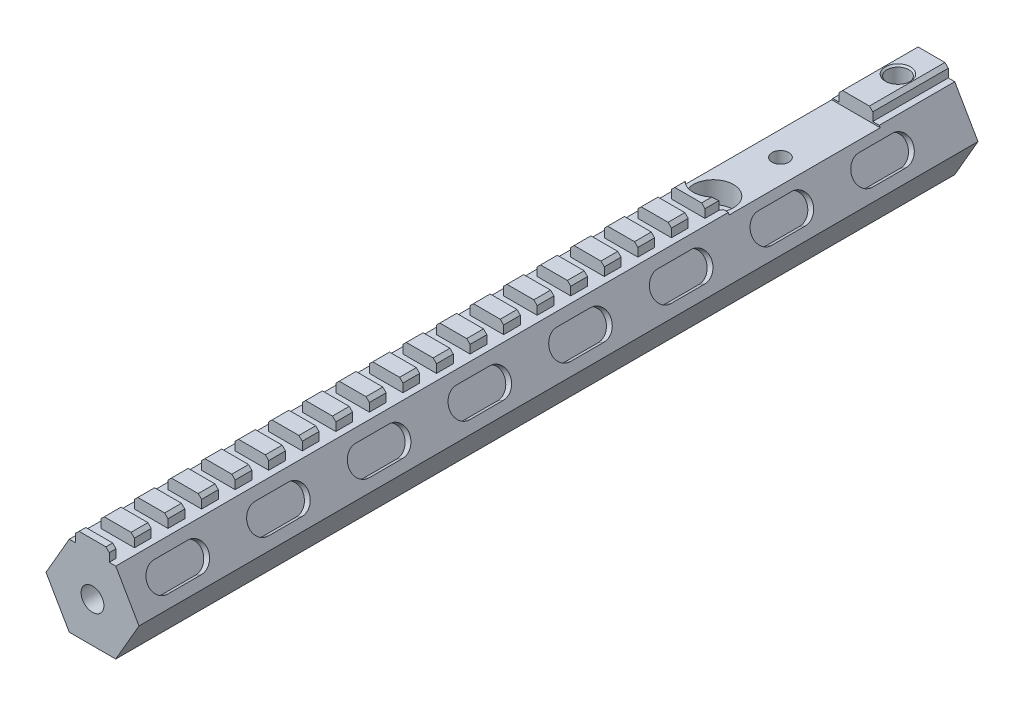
SolidWorks part; units mm, degrees
ref_plane "前视基准面" through (0, 0, 0) normal (0, 0, 1) x (1, 0, 0)
ref_plane "上视基准面" through (0, 0, 0) normal (0, 1, 0) x (1, 0, 0)
ref_plane "右视基准面" through (0, 0, 0) normal (1, 0, 0) x (0, 0, -1)
sketch "草图1" plane through (0, 0, 0) normal (0, 0, 1) x (1, 0, 0)
  line L1 (-13.8564, 0) -> (-6.9282, -12)
  line L2 (-6.9282, -12) -> (6.9282, -12)
  line L3 (6.9282, -12) -> (13.8564, 0)
  line L4 (13.8564, 0) -> (6.9282, 12)
  line L5 (6.9282, 12) -> (-6.9282, 12)
  line L6 (-6.9282, 12) -> (-13.8564, 0)
  circle A0 centre (0, 0) radius 12 construction
  point P1 (0, -12)
  dimension "D1" = 24
extrude "凸台-拉伸1" add sketch "草图1" along normal blind 250
sketch "草图2" plane through (0, 0, 0) normal (0, 0, 1) x (1, 0, 0)
  line L0 (6.9282, 12) -> (-6.9282, 12) construction
  line L1 (-5, 8.5) -> (5, 8.5)
  line L2 (-5, 8.5) -> (-5, 15.5)
  line L3 (-5, 15.5) -> (5, 15.5)
  line L4 (5, 8.5) -> (5, 15.5)
  line L5 (-5, 8.5) -> (5, 15.5) construction
  line L6 (-5, 15.5) -> (5, 8.5) construction
  point P0 (0, 12)
  dimension "D1" = 10
  dimension "D2" = 27.5
extrude "凸台-拉伸2" add sketch "草图2" along normal blind 22.5
chamfer "倒角3" distance 1 angle 45 2 edges at (-5, 15.5, 11.25) (5, 15.5, 11.25)
sketch "草图7" plane through (0, 0, 0) normal (0, 0, -1) x (-1, 0, 0)
  line L0 (-5, 12) -> (5, 12)
  line L13 (5, 12) -> (5, 14.5)
  line L14 (5, 14.5) -> (4, 15.5)
  line L15 (4, 15.5) -> (-4, 15.5)
  line L16 (-4, 15.5) -> (-5, 14.5)
  line L17 (-5, 14.5) -> (-5, 12)
  line L18 (-5, 12) -> (-6.9282, 12)
  line L19 (-6.9282, 12) -> (-13.8564, 0)
  line L20 (-13.8564, 0) -> (-6.9282, -12)
  line L21 (-6.9282, -12) -> (6.9282, -12)
  line L22 (6.9282, -12) -> (13.8564, 0)
  line L23 (13.8564, 0) -> (6.9282, 12)
  line L24 (6.9282, 12) -> (5, 12)
  line L25 (5, 12) -> (5, 14.5)
  line L26 (5, 14.5) -> (4, 15.5)
  line L27 (4, 15.5) -> (-4, 15.5)
  line L28 (-4, 15.5) -> (-5, 14.5)
  line L29 (-5, 14.5) -> (-5, 12)
  dimension "D1" = 0
extrude "凸台-拉伸3" add sketch "草图7" against normal blind 5 from offset 67.5
pattern_linear "阵列(线性)1" count 18 spacing 10 along (0, 0, 1) of "凸台-拉伸3"
sketch "草图8" plane through (0, 0, 242.5) normal (0, 0, 1) x (1, 0, 0)
  line L6 (5, 12) -> (5, 14.5)
  line L7 (5, 14.5) -> (4, 15.5)
  line L8 (4, 15.5) -> (-4, 15.5)
  line L9 (-4, 15.5) -> (-5, 14.5)
  line L10 (-5, 14.5) -> (-5, 12)
  line L11 (-5, 12) -> (5, 12)
  line L12 (5, 12) -> (5, 14.5)
  line L13 (5, 14.5) -> (4, 15.5)
  line L14 (4, 15.5) -> (-4, 15.5)
  line L15 (-4, 15.5) -> (-5, 14.5)
  line L16 (-5, 14.5) -> (-5, 12)
  line L17 (-5, 12) -> (5, 12)
  dimension "D1" = 0
extrude "凸台-拉伸4" add sketch "草图8" against normal blind 2 from surface at 7.5
sketch "草图10" plane through (-10.3923, 6, 0) normal (-0.866, 0.5, 0) x (0, 0, 1)
  line L0 (20, -0.0282) -> (30, -0.0282) construction
  line L1 (20, 3.9718) -> (30, 3.9718)
  line L2 (20, -4.0282) -> (30, -4.0282)
  line L3 (0, 6.9282) -> (0, -6.9282) construction
  line L6 (250, -6.9282) -> (0, -6.9282) construction
  arc A0 (20, 3.9718) -> (20, -4.0282) centre (20, -0.0282) ccw
  arc A1 (30, -4.0282) -> (30, 3.9718) centre (30, -0.0282) ccw
  point P3 (25, -0.0282)
  point P8 (16, -0.0282)
  point P11 (34, -0.0282)
  dimension "D3" = 4
  dimension "D1" = 16
  dimension "D2" = 18
  dimension "D4" = 2.9
extrude "切除-拉伸1" cut sketch "草图10" against normal blind 2
pattern_linear "阵列(线性)2" count 8 spacing 30 along (0, 0, 1) of "切除-拉伸1"
mirror "镜向1" about plane through (0, 0, 0) normal (1, 0, 0) of "阵列(线性)2", "切除-拉伸1"
sketch "草图11" plane through (0, 0, 0) normal (0, 0, -1) x (-1, 0, 0)
  line L0 (-3.6208, 6.7) -> (3.6208, 6.7)
  arc A0 (-8.1467, 3.825) -> (8.1467, 3.825) centre (0, 0) ccw
  arc A1 (8.1467, 3.825) -> (3.6208, 6.7) centre (3.6208, 1.7) ccw
  arc A2 (-8.1467, 3.825) -> (-3.6208, 6.7) centre (-3.6208, 1.7) cw
  dimension "D1" = 15.7
  dimension "D2" = 5
extrude "切除-拉伸2" cut sketch "草图11" against normal blind 21
sketch "草图12" plane through (0, 15.5, 0) normal (0, 1, 0) x (1, 0, 0)
  line L0 (4, 0) -> (-4, 0) construction
  circle A0 centre (0, -10) radius 3.25
  dimension "D1" = 6.5
  dimension "D2" = 10
extrude "切除-拉伸3" cut sketch "草图12" against normal up to next
chamfer "倒角5" distance 0.5 angle 45 1 edges at (0, 15.5, 13.25)
hole_wizard "M8 螺纹孔1" positions "草图13" profile "草图14" tap size "M8" standard "GB"
sketch "草图13" plane through (0, 0, 250) normal (0, 0, 1) x (1, 0, 0)
  point P0 (0, 0)
sketch "草图14" plane through (0, 0, 250) normal (1, 0, 0) x (0, -1, 0)
  line L0 (0, 0) -> (0, 27.0429)
  line L1 (0, 27.0429) -> (3.4, 25)
  line L2 (3.4, 25) -> (3.4, 0)
  line L5 (3.4, 0) -> (0, 0)
  line L10 (0, 27.0429) -> (-3.4, 25) construction
  line L11 (0, -6.35) -> (0, 107.95) construction
  dimension "螺纹孔钻头直径" = 6.8
  dimension "螺纹孔钻头深度" = 25
  dimension "导头角度" = 118
hole_wizard "M6 螺纹孔1" positions "草图15" profile "草图16" tap size "M6" standard "GB"
sketch "草图15" plane through (0, -12, 0) normal (0, -1, 0) x (-1, 0, 0)
  line L0 (6.9282, -250) -> (-6.9282, -250) construction
  point P0 (0, -170)
  dimension "D1" = 80
sketch "草图16" plane through (0, -12, 170) normal (1, 0, 0) x (0, 0, -1)
  line L0 (0, 0) -> (0, 16.5022)
  line L1 (0, 16.5022) -> (2.5, 15)
  line L2 (2.5, 15) -> (2.5, 0)
  line L5 (2.5, 0) -> (0, 0)
  line L10 (0, 16.5022) -> (-2.5, 15) construction
  line L11 (0, -6.35) -> (0, 107.95) construction
  dimension "螺纹孔钻头直径" = 5
  dimension "螺纹孔钻头深度" = 15
  dimension "导头角度" = 118
sketch "草图19" plane through (-10.3923, 6, 0) normal (-0.866, 0.5, 0) x (0, 0, 1)
sketch "草图20" plane through (0, 0, 0) normal (1, 0, 0) x (0, 0, -1)
  line L0 (-22.5, 11.5) -> (-67.5, 11.5)
  line L1 (-67.5, 11.5) -> (-67.5, 12)
  line L2 (-22.5, 11.5) -> (-22.5, 12)
  line L3 (-22.5, 14.5) -> (-22.5, 12) construction
  line L5 (-67.5, 12) -> (-67.5, 14.5) construction
  line L6 (-250, 12) -> (0, 12) construction
  point P2 (-22.5, 11.75)
  dimension "D1" = 0.5
extrude "切除-拉伸4" cut sketch "草图20" against normal through all and the other way through all
sketch "草图17" plane through (0, 0, 0) normal (1, 0, 0) x (0, 0, -1)
  line L0 (-65, 33.0007) -> (-65, -30.3352) construction
  line L1 (-65, 21.0456) -> (-59, 21.0456)
  line L2 (-59, 21.0456) -> (-59, 5.0456)
  line L3 (-59, 5.0456) -> (-61.3225, 5.0456)
  line L4 (-61.3225, 5.0456) -> (-61.3225, -16.4139)
  line L5 (-61.3225, -16.4139) -> (-65, -16.4139)
  line L6 (-65, -16.4139) -> (-65, 21.0456)
  dimension "D1" = 185
  dimension "D2" = 6
  dimension "D3" = 16
revolve "切除-旋转1" cut sketch "草图17" angle 360 about L0
hole_wizard "M6 螺纹孔2" positions "草图21" profile "草图22" tap size "M6" standard "GB"
sketch "草图21" plane through (0, 11.5, 0) normal (0, 1, 0) x (1, 0, 0)
  line L0 (7.2169, -22.5) -> (-7.2169, -22.5) construction
  point P0 (0, -45)
  point P5 (0, -22.5)
  dimension "D1" = 22.5
sketch "草图22" plane through (0, 11.5, 45) normal (1, 0, 0) x (0, 0, 1)
  line L0 (0, 0) -> (0, 16.5022)
  line L1 (0, 16.5022) -> (2.5, 15)
  line L2 (2.5, 15) -> (2.5, 0)
  line L5 (2.5, 0) -> (0, 0)
  line L10 (0, 16.5022) -> (-2.5, 15) construction
  line L11 (0, -6.35) -> (0, 107.95) construction
  dimension "螺纹孔钻头直径" = 5
  dimension "螺纹孔钻头深度" = 15
  dimension "导头角度" = 118
